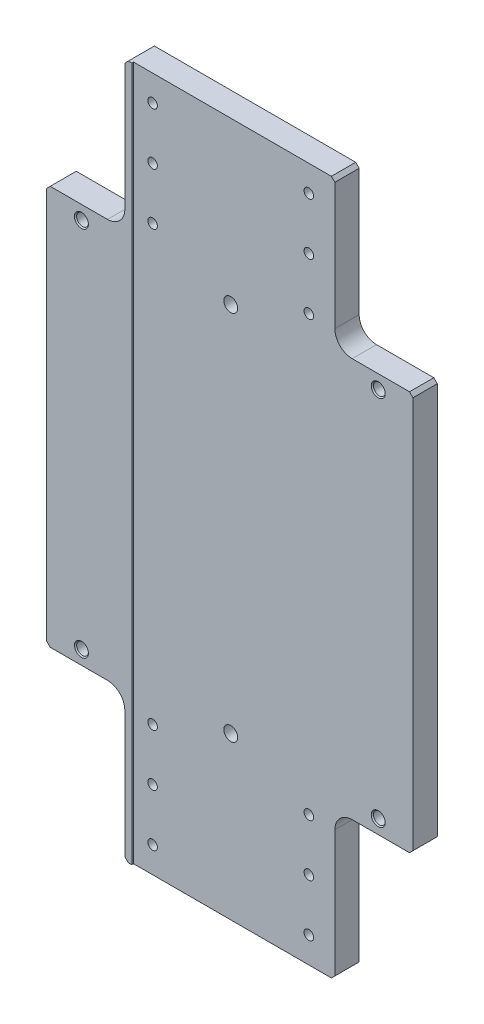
SolidWorks part; units mm, degrees
ref_plane "정면" through (0, 0, 0) normal (0, 0, 1) x (1, 0, 0)
ref_plane "윗면" through (0, 0, 0) normal (0, 1, 0) x (1, 0, 0)
ref_plane "우측면" through (0, 0, 0) normal (1, 0, 0) x (0, 0, -1)
sketch "스케치1" plane through (0, 0, 0) normal (0, 0, 1) x (1, 0, 0)
  line L0 (60, 115) -> (105, 115)
  line L1 (-60, 200) -> (60, 200)
  line L2 (-60, 200) -> (-60, 115)
  line L3 (-60, -200) -> (60, -200)
  line L4 (60, 200) -> (60, 115)
  line L5 (-60, 200) -> (60, -200) construction
  line L6 (-60, -200) -> (60, 200) construction
  line L7 (105, 115) -> (105, -115)
  line L8 (105, -115) -> (60, -115)
  line L9 (-60, 115) -> (-105, 115)
  line L10 (-105, 115) -> (-105, -115)
  line L11 (-105, -115) -> (-60, -115)
  line L12 (-60, -115) -> (-60, -200)
  line L13 (60, -115) -> (60, -200)
  point P0 (0, 0)
  dimension "D1" = 230
  dimension "D2" = 85
  dimension "D3" = 85
  dimension "D4" = 120
  dimension "D5" = 45
  dimension "D6" = 45
extrude "보스-돌출1" add sketch "스케치1" along normal mid plane 15
sketch "스케치2" plane through (0, 0, 7.5) normal (0, 0, 1) x (1, 0, 0)
  line L0 (60, 200) -> (-60, 200) construction
  line L1 (-56, 200) -> (105, 200)
  line L2 (-56, 200) -> (-56, -200)
  line L3 (-56, -200) -> (105, -200)
  line L4 (105, 200) -> (105, -200)
  line L5 (105, -115) -> (105, 115) construction
  line L6 (-60, -200) -> (60, -200) construction
  line L7 (-105, 115) -> (-105, -115) construction
  dimension "D1" = 49
extrude "컷-돌출1" cut sketch "스케치2" against normal blind 1
hole_wizard "M8 나사 구멍1" positions "스케치3" profile "스케치4" tap size "M8" standard "ISO"
sketch "스케치3" plane through (0, 0, 7.5) normal (0, 0, 1) x (1, 0, 0)
  line L0 (-105, 115) -> (-105, -115) construction
  line L2 (60, 200) -> (-56, 200) construction
  point P0 (-85, 107)
  point P2 (-85, -107)
  dimension "D1" = 214
  dimension "D2" = 20
  dimension "D3" = 93
sketch "스케치4" plane through (-85, 107, 7.5) normal (1, 0, 0) x (0, -1, 0)
  line L0 (0, 0) -> (0, 15)
  line L1 (0, 15) -> (4.025, 15)
  line L2 (3.4, 14.375) -> (3.4, 0.625)
  line L3 (3.4, 0.625) -> (4.025, 0)
  line L5 (4.025, 0) -> (0, 0)
  line L6 (-3.4, 0.625) -> (-4.025, 0) construction
  line L7 (4.025, 15) -> (3.4, 14.375)
  line L8 (-4.025, 15) -> (-3.4, 14.375) construction
  line L11 (0, -6.35) -> (0, 107.95) construction
  dimension "관통 탭 드릴 지름" = 6.8
  dimension "관통 탭 드릴 깊이" = 15
  dimension "표면 카운터싱크 지름" = 8.05
  dimension "표면 카운터싱크 각도" = 90
  dimension "안쪽면 카운터싱크 지름" = 8.05
  dimension "안쪽면 카운터싱크 각도" = 90
hole_wizard "M8 나사 구멍2" positions "스케치5" profile "스케치6" tap size "M8" standard "ISO"
sketch "스케치5" plane through (0, 0, 6.5) normal (0, 0, 1) x (1, 0, 0)
  line L0 (60, 200) -> (-56, 200) construction
  line L1 (105, -115) -> (105, 115) construction
  point P0 (85, 107)
  point P2 (85, -107)
  dimension "D1" = 214
  dimension "D2" = 93
  dimension "D3" = 20
sketch "스케치6" plane through (85, 107, 6.5) normal (1, 0, 0) x (0, -1, 0)
  line L0 (0, 0) -> (0, 14)
  line L1 (0, 14) -> (4.025, 14)
  line L2 (3.4, 13.375) -> (3.4, 0.625)
  line L3 (3.4, 0.625) -> (4.025, 0)
  line L5 (4.025, 0) -> (0, 0)
  line L6 (-3.4, 0.625) -> (-4.025, 0) construction
  line L7 (4.025, 14) -> (3.4, 13.375)
  line L8 (-4.025, 14) -> (-3.4, 13.375) construction
  line L11 (0, -6.35) -> (0, 107.95) construction
  dimension "관통 탭 드릴 지름" = 6.8
  dimension "관통 탭 드릴 깊이" = 14
  dimension "표면 카운터싱크 지름" = 8.05
  dimension "표면 카운터싱크 각도" = 90
  dimension "안쪽면 카운터싱크 지름" = 8.05
  dimension "안쪽면 카운터싱크 각도" = 90
hole_wizard "Ø8.0mm 맞춤핀 구멍1" positions "스케치7" profile "스케치8" hole size "Ø8.0" standard "ISO"
sketch "스케치7" plane through (0, 0, 6.5) normal (0, 0, 1) x (1, 0, 0)
  line L0 (0, 0) -> (0, 213.1022) construction
  line L1 (60, 200) -> (-56, 200) construction
  point P4 (0, 107)
  point P6 (0, -107)
  dimension "D1" = 93
  dimension "D2" = 214
sketch "스케치8" plane through (0, -107, 6.5) normal (1, 0, 0) x (0, -1, 0)
  line L0 (0, 0) -> (0, 14)
  line L1 (0, 14) -> (4, 14)
  line L2 (4, 14) -> (4, 0)
  line L5 (4, 0) -> (0, 0)
  line L11 (0, -6.35) -> (0, 107.95) construction
  dimension "관통 구멍 지름" = 8
  dimension "관통 구멍 깊이" = 14
hole_wizard "M5 소켓 머리 캡 나사용 카운터보어1" positions "스케치9" profile "스케치10" counterbore size "M5" standard "KS"
sketch "스케치9" plane through (0, 0, -7.5) normal (0, 0, -1) x (-1, 0, 0)
  line L0 (-60, 115) -> (-60, 200) construction
  line L1 (-60, 200) -> (60, 200) construction
  point P0 (-45, 185)
  point P2 (45, 185)
  point P4 (-45, 155)
  point P6 (45, 155)
  point P8 (-45, 125)
  point P10 (45, 125)
  dimension "D1" = 90
  dimension "D2" = 15
  dimension "D3" = 15
  dimension "D4" = 30
  dimension "D5" = 30
sketch "스케치10" plane through (45, 185, -7.5) normal (1, 0, 0) x (0, 1, 0)
  line L0 (0, 0) -> (0, 15)
  line L1 (0, 15) -> (2.75, 15)
  line L3 (2.75, 15) -> (2.75, 7)
  line L4 (2.75, 7) -> (4.75, 7)
  line L5 (4.75, 7) -> (4.75, 0)
  line L7 (4.75, 0) -> (0, 0)
  line L11 (0, -6.35) -> (0, 107.95) construction
  dimension "관통 구멍 지름" = 5.5
  dimension "관통 구멍 깊이" = 15
  dimension "카운터보어 지름" = 9.5
  dimension "카운터보어 깊이" = 7
pattern_linear "선형 패턴1" count 2 spacing 310 along (0, -1, 0) of "M5 소켓 머리 캡 나사용 카운터보어1"
fillet "필렛1" radius 10 4 edges at (60, -115, -0.5) (-60, -115, 0) (-60, 115, 0) (60, 115, -0.5)
chamfer "모따기1" distance 2 angle 45 8 edges at (-105, 115, 0) (-60, 200, 0) (-105, -115, 0) (-60, -200, 0) (60, -200, -0.5) (105, -115, -0.5) (105, 115, -0.5) (60, 200, -0.5)
